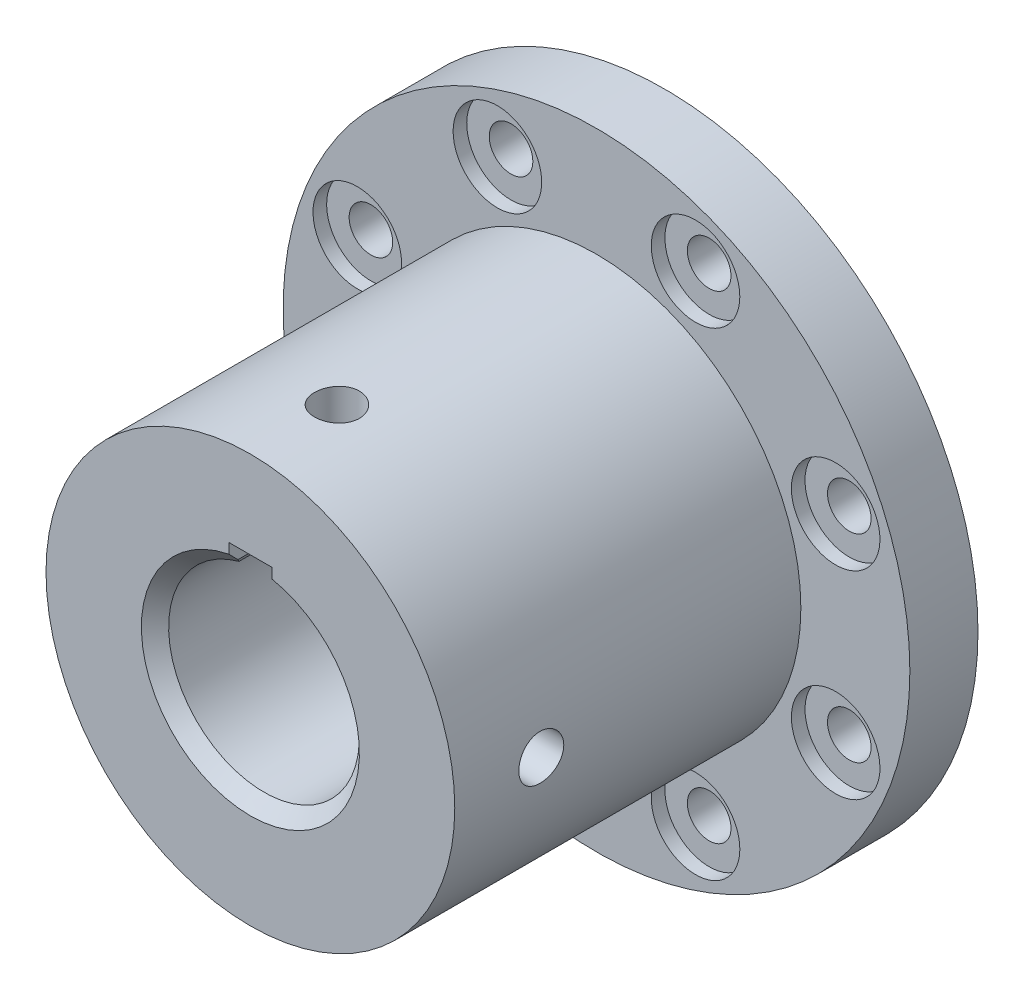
SolidWorks part; units mm, degrees
ref_plane "Front Plane" through (0, 0, 0) normal (0, 0, 1) x (1, 0, 0)
ref_plane "Top Plane" through (0, 0, 0) normal (0, 1, 0) x (1, 0, 0)
ref_plane "Right Plane" through (0, 0, 0) normal (1, 0, 0) x (0, 0, -1)
sketch "Sketch1" plane through (0, 0, 0) normal (0, 0, 1) x (1, 0, 0)
  circle A0 centre (0, 0) radius 23
  dimension "D1" = 46
extrude "Boss-Extrude1" add sketch "Sketch1" along normal blind 5
sketch "Sketch4" plane through (0, 0, 5) normal (0, 0, 1) x (1, 0, 0)
  circle A0 centre (0, 0) radius 2
extrude "Cut-Extrude2" cut sketch "Sketch4" against normal blind 5
sketch "Sketch7" plane through (0, 0, 5) normal (0, 0, 1) x (1, 0, 0)
  circle A0 centre (0, 0) radius 17.5
hole_wizard "Ø3.2 (3.2) Diameter Hole1" positions "Sketch9" profile "Sketch8" hole size "Ø3.2" standard "Ansi Metric"
sketch "Sketch9" plane through (0, 0, 5) normal (0, 0, 1) x (1, 0, 0)
  point P0 (7.27, 17.5541)
  dimension "D1" = 19
  dimension "D2" = 7.27
sketch "Sketch8" plane through (7.27, 17.5541, 5) normal (1, 0, 0) x (0, -1, 0)
  line L0 (0, 0) -> (0, 5)
  line L1 (0, 5) -> (1.6, 5)
  line L2 (1.6, 5) -> (1.6, 0)
  line L5 (1.6, 0) -> (0, 0)
  line L11 (0, -6.35) -> (0, 107.95) construction
  dimension "Thru Hole Dia." = 3.2
  dimension "Thru Hole Depth" = 5
sketch "Sketch13" plane through (0, 0, 5) normal (0, 0, 1) x (1, 0, 0)
  circle A0 centre (7.27, 17.5541) radius 3.25
  dimension "D1" = 6.5
extrude "Cut-Extrude3" cut sketch "Sketch13" against normal blind 1
pattern_circular "CirPattern1" count 8 over 360 about axis through (0, 0, 0) along (0, 0, 1) of "Ø3.2 (3.2) Diameter Hole1", "Cut-Extrude3"
sketch "Sketch10" plane through (0, 0, 5) normal (0, 0, 1) x (1, 0, 0)
  circle A0 centre (0, 0) radius 7
  circle A1 centre (0, 0) radius 15
  dimension "D1" = 14
  dimension "D2" = 30
extrude "Boss-Extrude2" add sketch "Sketch10" along normal blind 25.4
ref_plane "Plane1" through (0, 15, 0) normal (0, 1, 0) x (-1, 0, 0)
hole_wizard "M4x0.7 Tapped Hole1" positions "Sketch12" profile "Sketch11" tap size "M4x0.7" standard "Ansi Metric"
sketch "Sketch12" plane through (0, 15, 0) normal (0, 1, 0) x (-1, 0, 0)
  line L0 (15, 5) -> (-15, 5) construction
  point P1 (0, 24.05)
  dimension "D1" = 19.05
sketch "Sketch11" plane through (0, 15, 24.05) normal (1, 0, 0) x (0, 0, 1)
  line L0 (0, 0) -> (0, 30)
  line L1 (0, 30) -> (1.65, 30)
  line L2 (1.65, 30) -> (1.65, 0)
  line L5 (1.65, 0) -> (0, 0)
  line L11 (0, -6.35) -> (0, 107.95) construction
  dimension "Thru Tap Drill Dia." = 3.3
  dimension "Thru Tap Drill Depth" = 30
pattern_circular "CirPattern2" count 2 over 90 of "M4x0.7 Tapped Hole1"
chamfer "Chamfer2" distance 1 angle 45 1 edges at (7, 0, 30.4)
ref_plane "Plane2" through (0, 7, 0) normal (0, -1, 0) x (1, 0, 0)
sketch "Sketch14" plane through (0, 7, 0) normal (0, -1, 0) x (1, 0, 0)
  line L0 (7, 5) -> (-7, 5) construction
  line L1 (-1.5875, 30.5) -> (-1.5875, 21.5)
  line L2 (1.5875, 21.5) -> (1.5875, 30.5)
  arc A0 (-1.5875, 21.5) -> (1.5875, 21.5) centre (0, 21.5) ccw
  arc A1 (1.5875, 30.5) -> (-1.5875, 30.5) centre (0, 30.5) ccw
  dimension "D1" = 16.5
  dimension "D2" = 9
extrude "Cut-Extrude4" cut sketch "Sketch14" against normal blind 1.5875 and the other way up to next
chamfer "Chamfer3" distance 0.25 angle 45 7 edges at (1.6491, 6.803, 23.9968) (-1.6412, 6.8049, 23.8802) (-1.5875, 6.8176, 26.9499) (-1.5875, 6.8176, 22.5501) (0.1644, 6.9981, 19.921) (1.5875, 6.8176, 22.5501) (1.5875, 6.8176, 26.9499)
